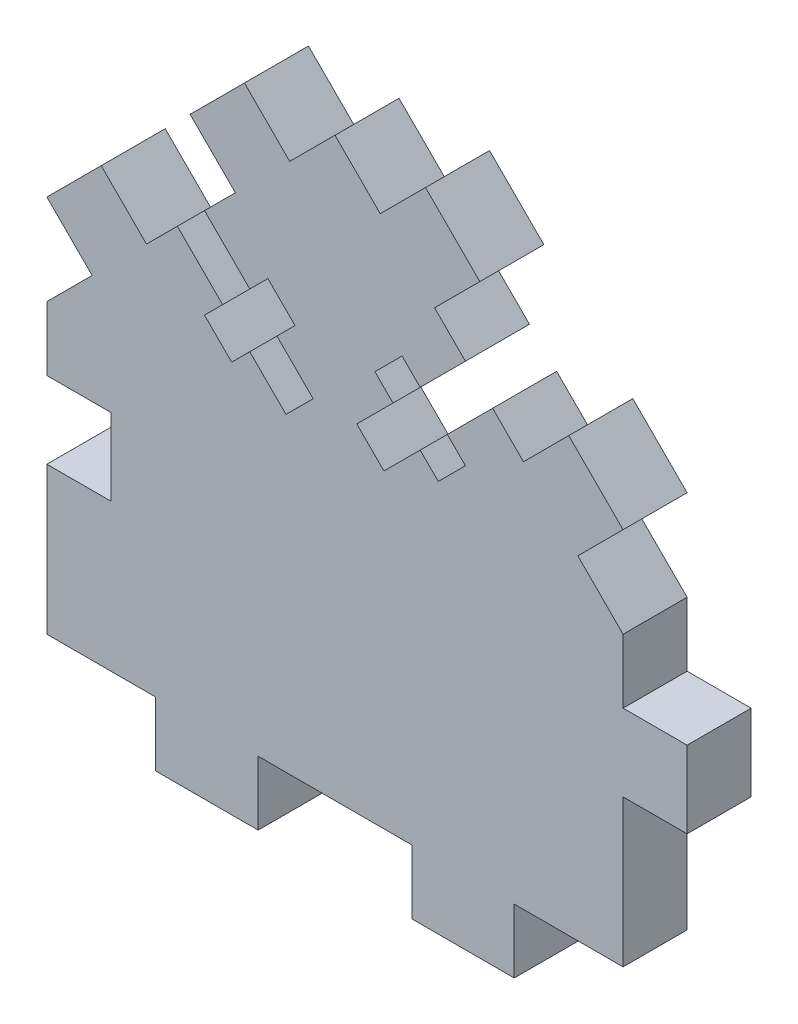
SolidWorks part; units mm, degrees
ref_plane "Front Plane" through (0, 0, 0) normal (0, 0, 1) x (1, 0, 0)
ref_plane "Top Plane" through (0, 0, 0) normal (0, 1, 0) x (1, 0, 0)
ref_plane "Right Plane" through (0, 0, 0) normal (1, 0, 0) x (0, 0, -1)
sketch "Sketch1" plane through (0, 0, 0) normal (0, 0, 1) x (1, 0, 0)
  line L0 (-28.575, 28.575) -> (-28.575, 57.15) construction
  line L1 (0, 0) -> (-57.15, 0)
  line L2 (0, 0) -> (0, 28.575)
  line L3 (0, 28.575) -> (-57.15, 28.575)
  line L4 (-57.15, 0) -> (-57.15, 28.575)
  line L5 (-57.15, 28.575) -> (-28.575, 57.15)
  line L6 (-28.575, 57.15) -> (0, 28.575)
  line L7 (-24.0849, 52.6599) -> (-18.6967, 47.2717)
  line L8 (-24.0849, 52.6599) -> (-19.5947, 57.15)
  line L9 (-18.6967, 47.2717) -> (-14.2066, 51.7618)
  line L10 (-19.5947, 57.15) -> (-14.2066, 51.7618)
  line L11 (-9.8783, 38.4533) -> (-4.4901, 33.0651)
  line L12 (-9.8783, 38.4533) -> (-5.3882, 42.9434)
  line L13 (-4.4901, 33.0651) -> (0, 37.5553)
  line L14 (-5.3882, 42.9434) -> (0, 37.5553)
  line L15 (-52.6599, 33.0651) -> (-47.2717, 38.4533)
  line L16 (-52.6599, 33.0651) -> (-57.15, 37.5553)
  line L17 (-47.2717, 38.4533) -> (-51.7618, 42.9434)
  line L18 (-57.15, 37.5553) -> (-51.7618, 42.9434)
  line L19 (-38.4533, 47.2717) -> (-33.0651, 52.6599)
  line L20 (-38.4533, 47.2717) -> (-42.9434, 51.7618)
  line L21 (-33.0651, 52.6599) -> (-37.5553, 57.15)
  line L22 (-42.9434, 51.7618) -> (-37.5553, 57.15)
  line L23 (-44.2095, 41.5155) -> (-41.5155, 44.2095)
  line L24 (-44.2095, 41.5155) -> (-33.4332, 30.7392)
  line L25 (-41.5155, 44.2095) -> (-30.7392, 33.4332)
  line L26 (-33.4332, 30.7392) -> (-30.7392, 33.4332)
  line L27 (-47.2717, 38.4533) -> (-38.4533, 47.2717) construction
  line L28 (-38.4533, 47.2717) -> (-47.2717, 38.4533) construction
  line L29 (-38.8214, 36.1273) -> (-37.7927, 35.0986)
  line L32 (-35.2293, 41.5155) -> (-32.5352, 38.8214)
  line L33 (-32.5352, 38.8214) -> (-38.8214, 32.5352)
  line L34 (-38.8214, 32.5352) -> (-41.5155, 35.2293)
  line L35 (-41.5155, 35.2293) -> (-35.2293, 41.5155)
  line L36 (-42.8625, 42.8625) -> (-29.3921, 29.3921) construction
  line L37 (-15.6345, 44.2095) -> (-12.9405, 41.5155)
  line L38 (-15.6345, 44.2095) -> (-26.4108, 33.4332)
  line L39 (-12.9405, 41.5155) -> (-23.7168, 30.7392)
  line L40 (-26.4108, 33.4332) -> (-23.7168, 30.7392)
  line L41 (-18.6967, 47.2717) -> (-9.8783, 38.4533) construction
  line L42 (-19.0913, 35.3646) -> (-16.4179, 38.038)
  line L45 (-24.6148, 38.8214) -> (-21.9207, 41.5155)
  line L46 (-24.6148, 38.8214) -> (-18.3286, 32.5352)
  line L47 (-18.3286, 32.5352) -> (-15.6345, 35.2293)
  line L48 (-15.6345, 35.2293) -> (-21.9207, 41.5155)
  line L49 (-14.2875, 42.8625) -> (-25.0638, 32.0862) construction
  point P7 (-42.8625, 42.8625)
  point P36 (-14.2875, 42.8625)
  point P49 (-40.6983, 49.5168)
  dimension "D1" = 57.15
  dimension "D2" = 28.575
  dimension "D3" = 28.575
  dimension "D4" = 6.35
  dimension "D5" = 6.35
  dimension "D6" = 7.62
  dimension "D7" = 7.62
  dimension "D8" = 6.35
  dimension "D9" = 6.35
  dimension "D10" = 6.35
  dimension "D11" = 6.35
  dimension "D12" = 7.62
  dimension "D13" = 7.62
  dimension "D14" = 6.35
  dimension "D15" = 6.35
  dimension "D16" = 3.81
  dimension "D17" = 1.905
  dimension "D18" = 15.24
  dimension "D19" = 3.81
  dimension "D20" = 3.81
  dimension "D21" = 8.89
  dimension "D22" = 4.445
  dimension "D23" = 15.24
  dimension "D24" = 5.08
  dimension "D25" = 3.81
  dimension "D26" = 1.905
  dimension "D27" = 5.08
  dimension "D28" = 3.81
  dimension "D29" = 3.81
  dimension "D30" = 4.445
  dimension "D31" = 8.89
  dimension "D32" = 12.4712
extrude "Boss-Extrude2" add sketch "Sketch1" along normal blind 6.35 contours L4 L1 L2 L3 | L48 L47 L46 L39 L40 L38 L45 L6 L5 L25 L35 L32 L33 L26 L24 L34 L3 | L18 L16 L5 L17 | L10 L8 L6 L9 | L14 L12 L6 L13 | L22 L21 L19 L20
sketch "Sketch31" plane through (0, 0, 6.35) normal (0, 0, 1) x (1, 0, 0)
  line L0 (-57.15, 0) -> (-57.15, 28.575) construction
  line L1 (-57.15, 22.225) -> (-50.8, 22.225)
  line L2 (-57.15, 22.225) -> (-57.15, 14.605)
  line L3 (-57.15, 14.605) -> (-50.8, 14.605)
  line L4 (-50.8, 22.225) -> (-50.8, 14.605)
  dimension "D1" = 6.35
  dimension "D2" = 7.62
  dimension "D5" = 6.35
extrude "Cut-Extrude1" cut sketch "Sketch31" against normal blind 6.35
sketch "Sketch32" plane through (0, 0, 0) normal (1, 0, 0) x (0, 0, -1)
  line L0 (0, 0) -> (0, 28.575) construction
  line L1 (-6.35, 22.225) -> (0, 22.225)
  line L2 (-6.35, 22.225) -> (-6.35, 14.605)
  line L3 (-6.35, 14.605) -> (0, 14.605)
  line L4 (0, 22.225) -> (0, 14.605)
  dimension "D1" = 7.62
extrude "Boss-Extrude3" add sketch "Sketch32" along normal blind 6.35
sketch "Sketch33" plane through (0, 0, 0) normal (0, -1, 0) x (1, 0, 0)
  line L0 (0, 6.35) -> (-57.15, 6.35) construction
  line L1 (-46.355, 6.35) -> (-36.195, 6.35)
  line L2 (-46.355, 6.35) -> (-46.355, 0)
  line L3 (-46.355, 0) -> (-36.195, 0)
  line L4 (-36.195, 6.35) -> (-36.195, 0)
  line L5 (0, 0) -> (-57.15, 0) construction
  line L6 (0, 6.35) -> (0, 0) construction
  line L7 (-20.955, 6.35) -> (-10.795, 6.35)
  line L8 (-20.955, 6.35) -> (-20.955, 0)
  line L9 (-20.955, 0) -> (-10.795, 0)
  line L10 (-10.795, 6.35) -> (-10.795, 0)
  dimension "D1" = 10.795
  dimension "D2" = 10.16
  dimension "D3" = 15.24
  dimension "D4" = 10.16
extrude "Boss-Extrude4" add sketch "Sketch33" along normal blind 6.35
